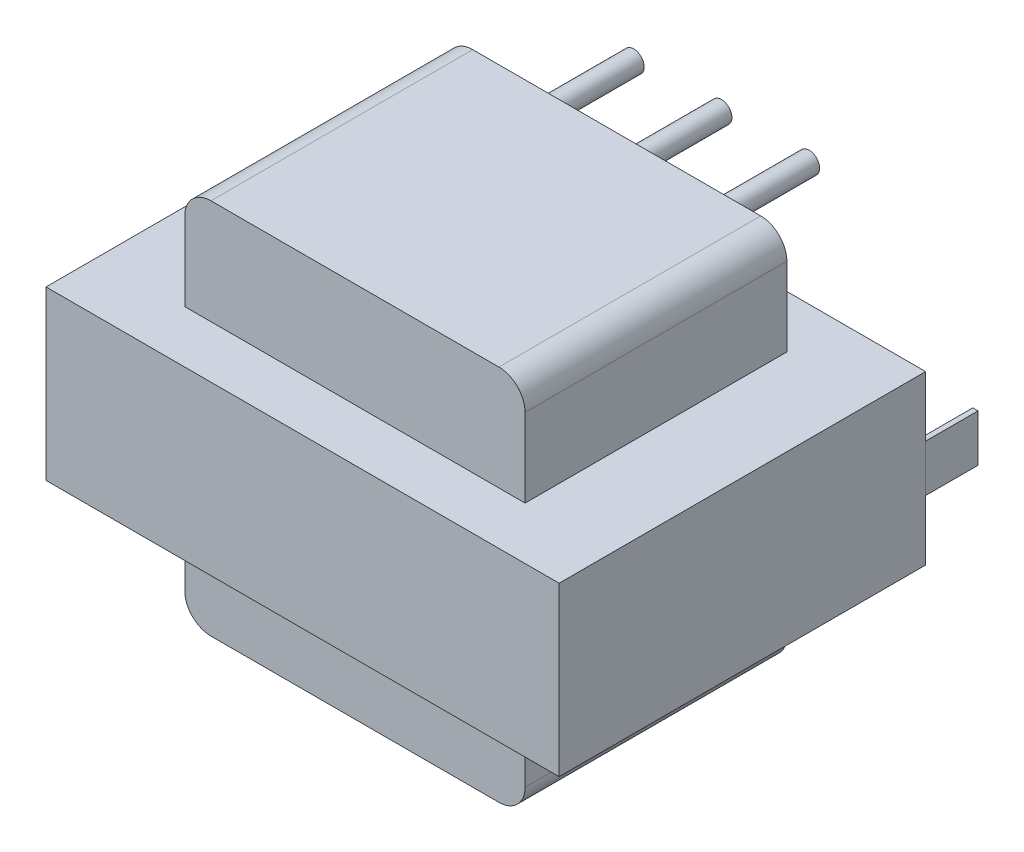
SolidWorks part; units mm, degrees
ref_plane "Front Plane" through (0, 0, 0) normal (0, 0, 1) x (1, 0, 0)
ref_plane "Top Plane" through (0, 0, 0) normal (0, 1, 0) x (1, 0, 0)
ref_plane "Right Plane" through (0, 0, 0) normal (1, 0, 0) x (0, 0, -1)
sketch "Sketch1" plane through (0, 0, 0) normal (0, 0, 1) x (1, 0, 0)
  line L1 (-6.985, 9.144) -> (6.985, 9.144)
  line L3 (-6.985, -9.144) -> (6.985, -9.144)
  line L6 (-8.255, 7.874) -> (-8.255, -7.874)
  line L8 (8.255, 7.874) -> (8.255, -7.874)
  arc A0 (6.985, -9.144) -> (8.255, -7.874) centre (6.985, -7.874) ccw
  arc A1 (8.255, 7.874) -> (6.985, 9.144) centre (6.985, 7.874) ccw
  arc A3 (-6.985, -9.144) -> (-8.255, -7.874) centre (-6.985, -7.874) cw
  arc A4 (-8.255, 7.874) -> (-6.985, 9.144) centre (-6.985, 7.874) cw
extrude "Boss-Extrude1" add sketch "Sketch1" along normal blind 12.7
sketch "Sketch2" plane through (0, 0, 0) normal (0, 0, -1) x (-1, 0, 0)
  circle A0 centre (4.2545, 7.493) radius 0.508
  circle A1 centre (0, 7.493) radius 0.508
  circle A2 centre (-4.2545, 7.493) radius 0.508
  circle A3 centre (4.2545, -7.493) radius 0.508
  circle A4 centre (0, -7.493) radius 0.508
  circle A5 centre (-4.2545, -7.493) radius 0.508
extrude "Boss-Extrude2" add sketch "Sketch2" along normal blind 5.08
sketch "Sketch3" plane through (0, 0, 0) normal (0, 0, -1) x (-1, 0, 0)
  line L1 (12.446, -4.064) -> (-12.446, -4.064)
  line L2 (12.446, -4.064) -> (12.446, 4.064)
  line L3 (12.446, 4.064) -> (-12.446, 4.064)
  line L4 (-12.446, -4.064) -> (-12.446, 4.064)
extrude "Boss-Extrude3" add sketch "Sketch3" along normal blind 2.54 and the other way blind 15.24 separate body
sketch "Sketch4" plane through (0, 0, -2.54) normal (0, 0, -1) x (-1, 0, 0)
  line L0 (12.446, -4.064) -> (12.446, 4.064) construction
  line L1 (12.446, -1.143) -> (12.192, -1.143)
  line L2 (12.446, -1.143) -> (12.446, 1.143)
  line L3 (12.446, 1.143) -> (12.192, 1.143)
  line L4 (12.192, -1.143) -> (12.192, 1.143)
  line L5 (-12.446, 4.064) -> (-12.446, -4.064) construction
  line L6 (-12.446, -1.143) -> (-12.192, -1.143)
  line L7 (-12.446, -1.143) -> (-12.446, 1.143)
  line L8 (-12.446, 1.143) -> (-12.192, 1.143)
  line L9 (-12.192, -1.143) -> (-12.192, 1.143)
extrude "Boss-Extrude4" add sketch "Sketch4" along normal blind 2.54 separate body
